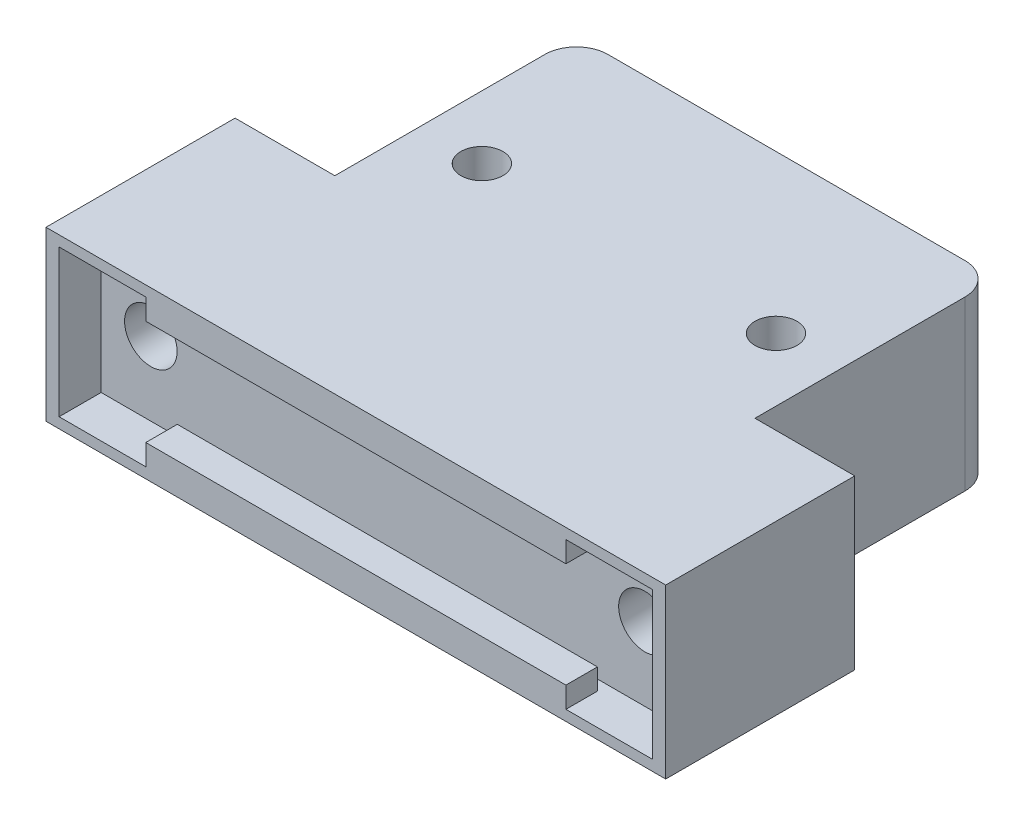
SolidWorks part; units mm, degrees
ref_plane "Front Plane" through (0, 0, 0) normal (0, 0, 1) x (1, 0, 0)
ref_plane "Top Plane" through (0, 0, 0) normal (0, 1, 0) x (1, 0, 0)
ref_plane "Right Plane" through (0, 0, 0) normal (1, 0, 0) x (0, 0, -1)
sketch "Sketch2" plane through (0, 0, 0) normal (0, 1, 0) x (1, 0, 0)
  line L0 (0, 78.7178) -> (0, -62.7974) construction
  line L1 (0, -77.8334) -> (0, 77.8334) construction
  line L2 (20, 23) -> (-20, 23)
  line L3 (-20, 23) -> (-20, 0)
  line L4 (-75.8875, 0) -> (75.8875, 0) construction
  line L5 (-20, 0) -> (-29.5, 0)
  line L6 (-29.5, 0) -> (-29.5, -18)
  line L7 (-29.5, -18) -> (29.5, -18)
  line L8 (29.5, 0) -> (29.5, -18)
  line L9 (20, 0) -> (29.5, 0)
  line L10 (20, 23) -> (20, 0)
  point P14 (0, -18)
  point P17 (0, 23)
  dimension "D1" = 40
  dimension "D2" = 59
  dimension "D3" = 18
  dimension "D4" = 41
extrude "Boss-Extrude1" add sketch "Sketch2" along normal mid plane 16
sketch "Sketch3" plane through (0, 0, 18) normal (0, 0, 1) x (1, 0, 0)
  line L1 (-28.25, 7) -> (28.25, 7)
  line L2 (-28.25, 7) -> (-28.25, -7)
  line L3 (-28.25, -7) -> (28.25, -7)
  line L4 (28.25, 7) -> (28.25, -7)
  line L5 (-28.25, 7) -> (28.25, -7) construction
  line L6 (-28.25, -7) -> (28.25, 7) construction
  point P0 (0, 0)
  dimension "D1" = 56.5
  dimension "D2" = 14
extrude "Cut-Extrude1" cut sketch "Sketch3" against normal blind 4
sketch "Sketch4" plane through (0, 0, 14) normal (0, 0, 1) x (1, 0, 0)
  line L0 (0, -8.8) -> (0, 8.8) construction
  circle A0 centre (-23.52, 0) radius 2.5
  dimension "D1" = 5
  dimension "D2" = 23.52
extrude "Cut-Extrude2" cut sketch "Sketch4" against normal through all
mirror "Mirror1" about plane through (0, 0, 0) normal (1, 0, 0) of "Cut-Extrude2"
sketch "Sketch6" plane through (0, -7, 0) normal (0, 1, 0) x (1, 0, 0)
  line L0 (-29.5, -18) -> (29.5, -18) construction
  line L1 (20, -18) -> (-20, -18)
  line L2 (20, -18) -> (20, -15)
  line L3 (20, -15) -> (-20, -15)
  line L4 (-20, -18) -> (-20, -15)
  line L5 (0, -8.8) -> (0, 8.8) construction
  dimension "D1" = 40
  dimension "D2" = 20
  dimension "D3" = 3
extrude "Boss-Extrude2" add sketch "Sketch6" along normal blind 2
mirror "Mirror2" about plane through (0, 0, 0) normal (0, 1, 0) of "Boss-Extrude2"
fillet "Fillet1" radius 3 2 edges at (20, 0, -23) (-20, 0, -23)
sketch "Sketch7" plane through (0, 8, 0) normal (0, 1, 0) x (1, 0, 0)
  line L0 (0, -8.8) -> (0, 8.8) construction
  line L1 (-29.5, -18) -> (29.5, -18) construction
  circle A0 centre (-14, 8) radius 2
  dimension "D1" = 4
  dimension "D2" = 14
  dimension "D3" = 26
extrude "Cut-Extrude3" cut sketch "Sketch7" against normal through all
mirror "Mirror3" about plane through (0, 0, 0) normal (1, 0, 0) of "Cut-Extrude3"
